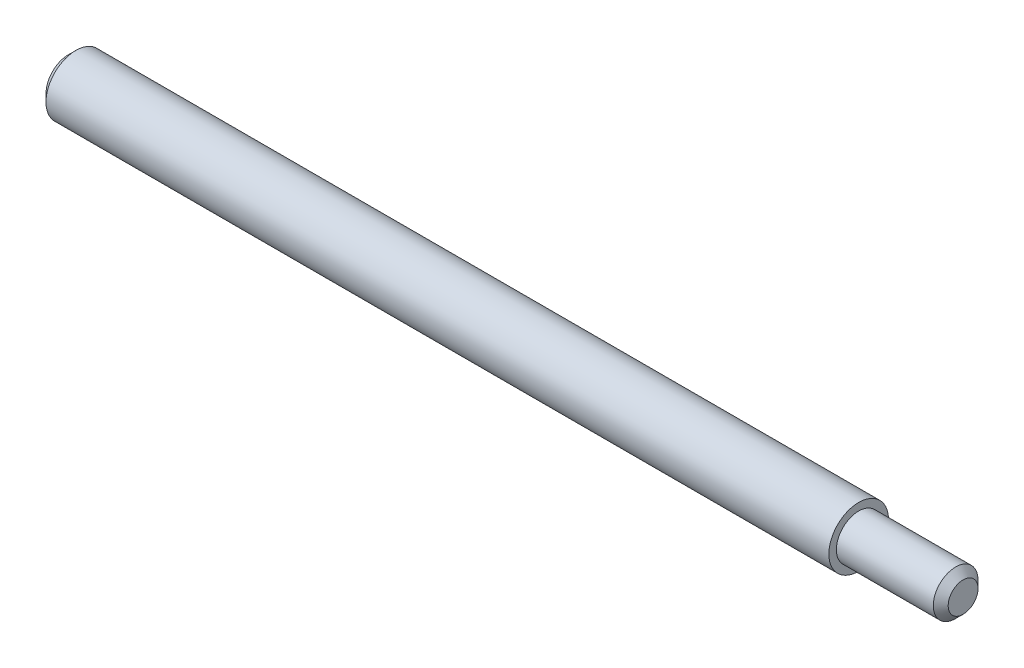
SolidWorks part; units mm, degrees
ref_plane "Frontal" through (0, 0, 0) normal (0, 0, 1) x (1, 0, 0)
ref_plane "Horizontal" through (0, 0, 0) normal (0, 1, 0) x (1, 0, 0)
ref_plane "Vertical" through (0, 0, 0) normal (1, 0, 0) x (0, 0, -1)
sketch "Esquisse1" plane through (0, 0, 0) normal (0, 0, 1) x (1, 0, 0)
  line L0 (0, 0) -> (120, 0)
  line L1 (120, 0) -> (120, 2)
  line L2 (-45.4748, 0) -> (139.8684, 0) construction
  line L4 (119, 3) -> (106, 3)
  line L5 (106, 3) -> (106, 4)
  line L6 (106, 4) -> (0, 4)
  line L7 (0, 0) -> (0, 4)
  line L8 (119, 3) -> (120, 2)
  dimension "D1" = 120
  dimension "D2" = 14
  dimension "D3" = 6
  dimension "D4" = 8
  dimension "D5" = 1
  dimension "D6" = 45
revolve "Révolution1" add sketch "Esquisse1" angle 360 about L2
chamfer "Chanfrein1" distance 1 angle 45 1 edges at (0, 0, 4)
